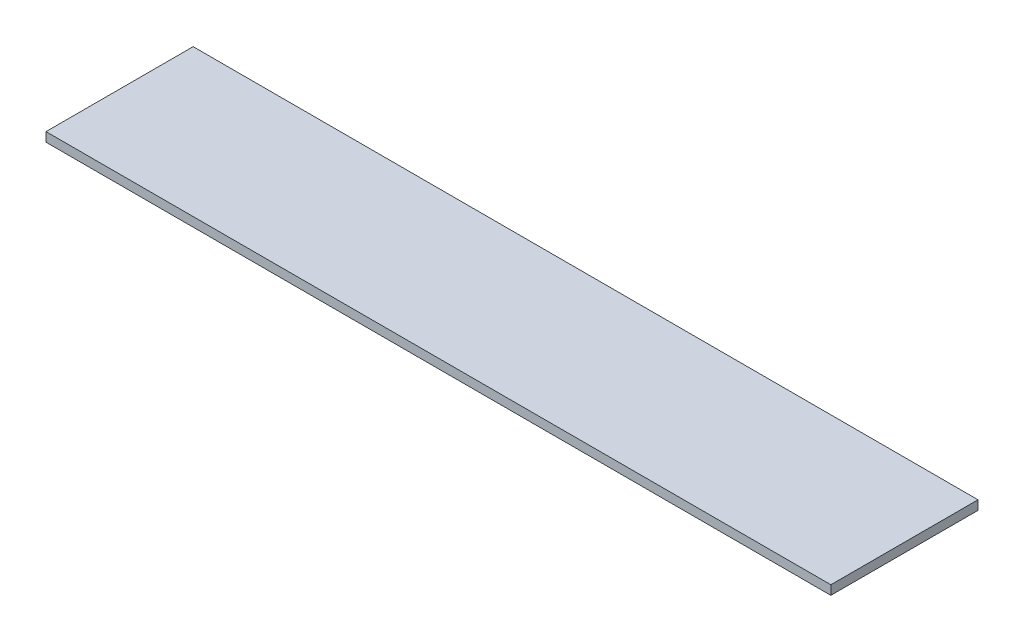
SolidWorks part; units mm, degrees
ref_plane "Front Plane" through (0, 0, 0) normal (0, 0, 1) x (1, 0, 0)
ref_plane "Top Plane" through (0, 0, 0) normal (0, 1, 0) x (1, 0, 0)
ref_plane "Right Plane" through (0, 0, 0) normal (1, 0, 0) x (0, 0, -1)
sketch "Sketch2" plane through (0, 0, 0) normal (0, 1, 0) x (1, 0, 0)
  line L1 (-812.8, 152.4) -> (812.8, 152.4)
  line L2 (-812.8, 152.4) -> (-812.8, -152.4)
  line L3 (-812.8, -152.4) -> (812.8, -152.4)
  line L4 (812.8, 152.4) -> (812.8, -152.4)
  line L5 (-812.8, 152.4) -> (812.8, -152.4) construction
  line L6 (-812.8, -152.4) -> (812.8, 152.4) construction
  point P0 (0, 0)
  dimension "D1" = 1625.6
  dimension "D2" = 304.8
extrude "Boss-Extrude1" add sketch "Sketch2" along normal blind 19.05
